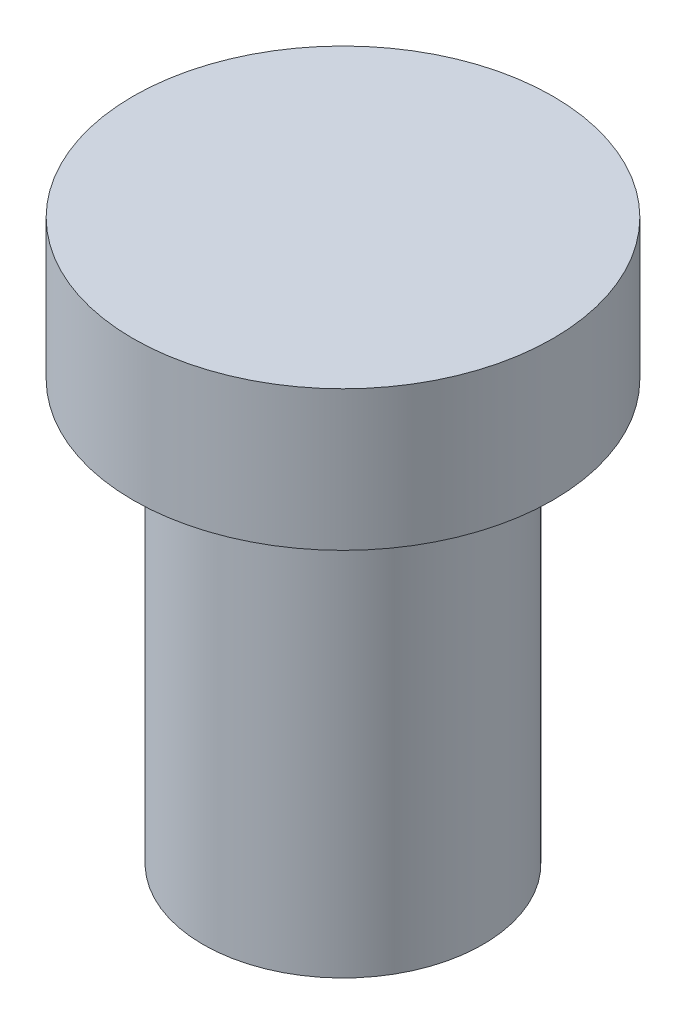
SolidWorks part; units mm, degrees
ref_plane "Front" through (0, 0, 0) normal (0, 0, 1) x (1, 0, 0)
ref_plane "Top" through (0, 0, 0) normal (0, 1, 0) x (1, 0, 0)
ref_plane "Right" through (0, 0, 0) normal (1, 0, 0) x (0, 0, -1)
sketch "Sketch1" plane through (0, 0, 0) normal (0, 0, 1) x (1, 0, 0)
  line L0 (0, 22.2548) -> (0, -39.8341) construction
  line L1 (0, 0) -> (7.5, 0)
  line L2 (7.5, 0) -> (7.5, -5)
  line L3 (7.5, -5) -> (5, -5)
  line L4 (5, -5) -> (5, -20)
  line L5 (5, -20) -> (0, -20)
  line L6 (0, -20) -> (0, 0)
  dimension "D1" = 10
  dimension "D2" = 15
  dimension "D3" = 20
  dimension "D4" = 5
revolve "Revolve1" add sketch "Sketch1" angle 360 about L0
